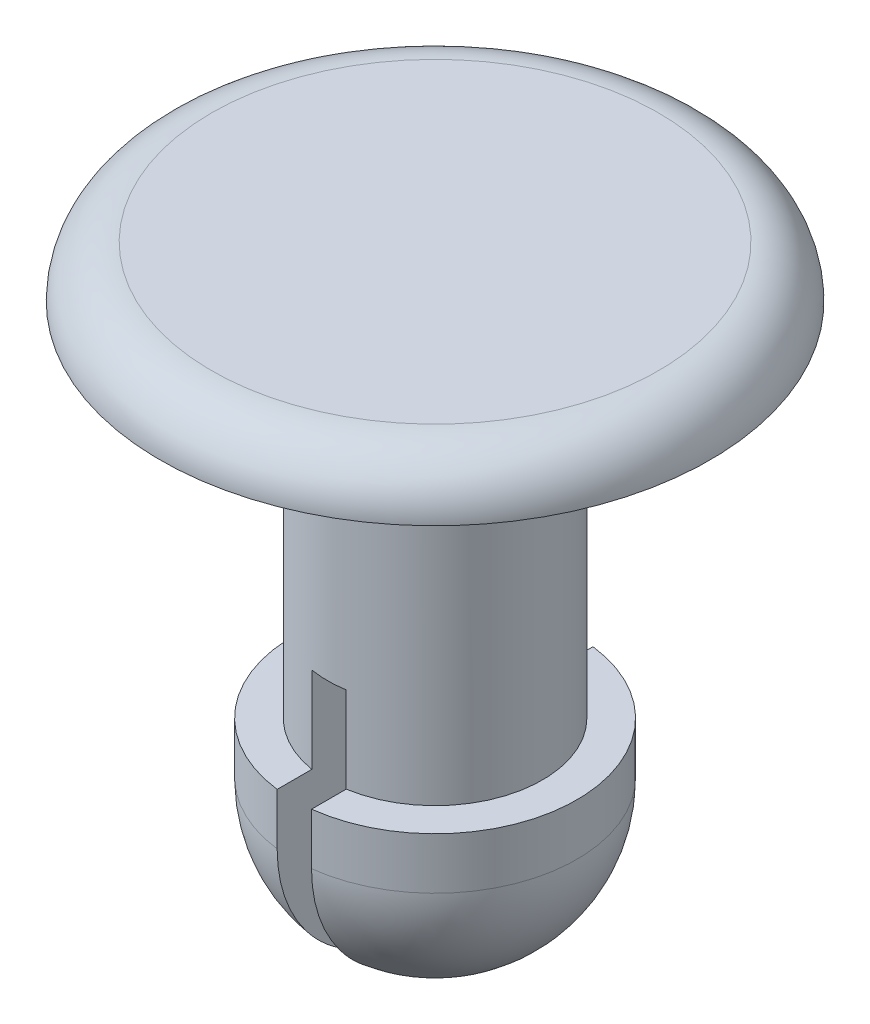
SolidWorks part; units mm, degrees
ref_plane "Plane1" through (0, 0, 0) normal (0, 0, 1) x (1, 0, 0)
ref_plane "Plane2" through (0, 0, 0) normal (0, 1, 0) x (1, 0, 0)
ref_plane "Plane3" through (0, 0, 0) normal (1, 0, 0) x (0, 0, -1)
sketch "Sketch1" plane through (0, 0, 0) normal (0, 0, 1) x (1, 0, 0)
  line L0 (0, 0) -> (0, -8.1915) construction
  line L1 (0, 0.762) -> (4.064, 0.762)
  line L2 (4.064, 0.762) -> (4.064, 0)
  line L3 (4.064, 0) -> (1.5875, 0)
  line L4 (1.5875, 0) -> (1.5875, -5.334)
  line L5 (1.5875, -5.334) -> (2.0955, -5.334)
  line L6 (2.0955, -5.334) -> (2.0955, -6.096)
  line L7 (0, -8.1915) -> (0, 0.762)
  arc A0 (2.0955, -6.096) -> (0, -8.1915) centre (0, -6.096) cw
  dimension "D1" = 1.5875
  dimension "D2" = 4.064
  dimension "D3" = 0.762
  dimension "D4" = 5.334
  dimension "D5" = 0.508
  dimension "D6" = 0.762
revolve "Base-Revolve" add sketch "Sketch1" angle 360 about L0
fillet "Fillet1" radius 0.762 1 edges at (-4.064, 0.762, 0)
sketch "Sketch2" plane through (0, 0, 0) normal (0, 0, 1) x (1, 0, 0)
  line L0 (-0.254, -4.064) -> (0.254, -4.064)
  line L1 (-0.254, -4.064) -> (-0.254, -8.1915)
  line L2 (0.254, -8.1915) -> (-0.254, -8.1915)
  line L3 (0.254, -8.1915) -> (0.254, -4.064)
  line L4 (-2.0955, -5.334) -> (2.0955, -5.334) construction
  dimension "D1" = 0.508
  dimension "D2" = 1.27
extrude "Slot" cut sketch "Sketch2" against normal through all and the other way through all
